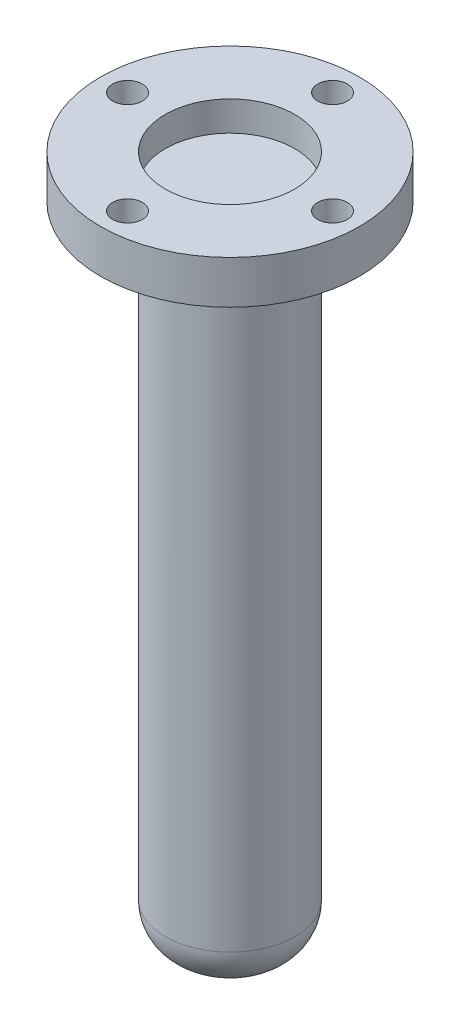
SolidWorks part; units mm, degrees
ref_plane "Front Plane" through (0, 0, 0) normal (0, 0, 1) x (1, 0, 0)
ref_plane "Top Plane" through (0, 0, 0) normal (0, 1, 0) x (1, 0, 0)
ref_plane "Right Plane" through (0, 0, 0) normal (1, 0, 0) x (0, 0, -1)
sketch "Sketch1" plane through (0, 0, 0) normal (0, 1, 0) x (1, 0, 0)
  circle A0 centre (0, 0) radius 24
  dimension "D1" = 48
extrude "Boss-Extrude1" add sketch "Sketch1" along normal blind 8
sketch "Sketch11" plane through (0, 0, 0) normal (0, 0, 1) x (1, 0, 0)
  line L0 (0, 0) -> (0, -120)
  line L1 (0, -120) -> (12, -120)
  line L2 (12, -120) -> (12, 0)
  line L3 (-24, 0) -> (24, 0) construction
  line L4 (12, 0) -> (0, 0)
  dimension "D1" = 12
  dimension "D2" = 120
revolve "Revolve1" add sketch "Sketch11" angle 360 about L0
fillet "Fillet1" radius 8 1 edges at (-12, -120, 0)
sketch "Sketch12" plane through (0, 8, 0) normal (0, 1, 0) x (1, 0, 0)
  circle A0 centre (0, 0) radius 12
  circle A1 centre (19, 0) radius 2.75
  circle A2 centre (0, -19) radius 2.75
  circle A3 centre (-19, 0) radius 2.75
  circle A4 centre (0, 19) radius 2.75
  point P13 (0, 0)
  dimension "D1" = 24
  dimension "D3" = 5.5
  dimension "D2" = 19
  dimension "D4" = 4
extrude "Cut-Extrude1" cut sketch "Sketch12" against normal blind 5.5
